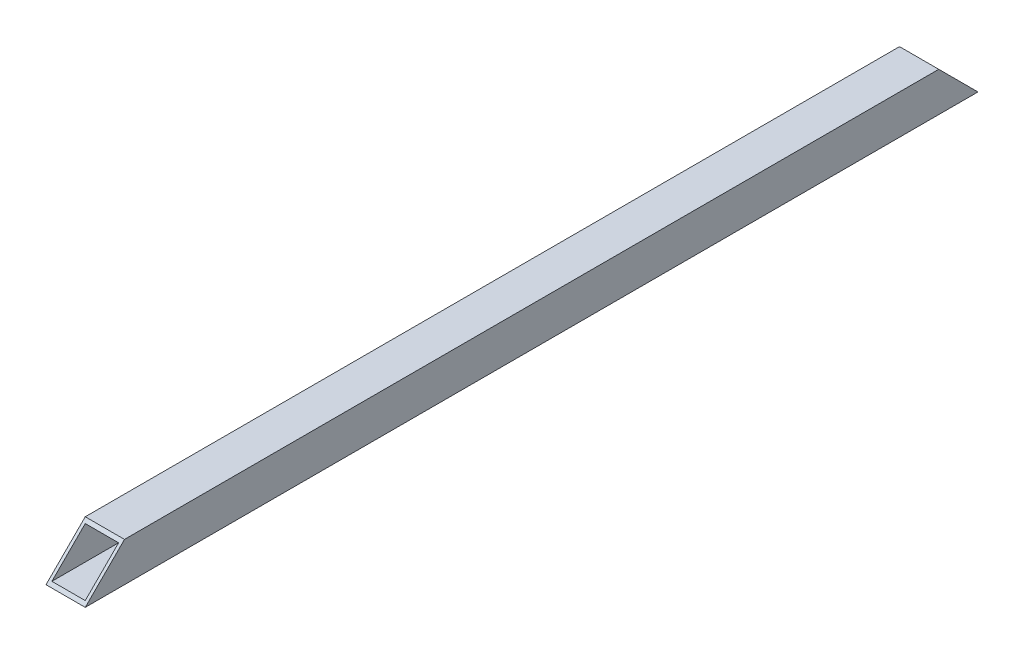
SolidWorks part; units mm, degrees
ref_plane "Plan de face" through (0, 0, 0) normal (0, 0, 1) x (1, 0, 0)
ref_plane "Plan de dessus" through (0, 0, 0) normal (0, 1, 0) x (1, 0, 0)
ref_plane "Plan de droite" through (0, 0, 0) normal (1, 0, 0) x (0, 0, -1)
sketch "Esquisse1" plane through (0, 0, 0) normal (0, 0, 1) x (1, 0, 0)
  line L1 (0, 0) -> (40, 0)
  line L2 (0, 0) -> (0, 40)
  line L3 (0, 40) -> (40, 40)
  line L4 (40, 0) -> (40, 40)
  line L5 (3, 37) -> (37, 37)
  line L6 (3, 37) -> (3, 3)
  line L7 (3, 3) -> (37, 3)
  line L8 (37, 37) -> (37, 3)
  dimension "D1" = 40
  dimension "D2" = 40
  dimension "D3" = 3
  dimension "D4" = 3
  dimension "D5" = 3
  dimension "D6" = 3
extrude "Extrusion1" add sketch "Esquisse1" along normal blind 910
chamfer "Chanfrein1" distance 40 distance2 40 1 edges at (20, 40, 910)
chamfer "Chanfrein2" distance 40 distance2 40 1 edges at (20, 40, 0)
ref_plane "Plan1" through (0, 0, 455) normal (0, 0, 1) x (1, 0, 0)
